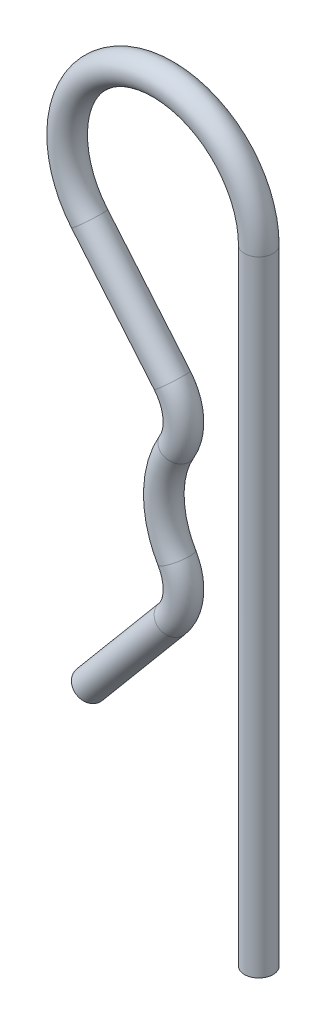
SolidWorks part; units mm, degrees
ref_plane "Plan1" through (0, 0, 0) normal (0, 0, 1) x (1, 0, 0)
ref_plane "Plan2" through (0, 0, 0) normal (0, 1, 0) x (1, 0, 0)
ref_plane "Plan3" through (0, 0, 0) normal (1, 0, 0) x (0, 0, -1)
sketch "Esquisse1" plane through (0, 0, 0) normal (0, 0, 1) x (1, 0, 0)
  line L0 (0, 0) -> (0, 23.55) construction
  line L1 (-10.5974, 12.6371) -> (-5.4182, 6.4611) construction
  line L2 (0, 0) -> (-23.55, 0) construction
  line L4 (0, 16.4925) -> (0, 0) construction
  line L5 (0, 0) -> (0, -22.6075) construction
  line L6 (-6, 22.4925) -> (0, 22.4925) construction
  line L7 (-10.5974, -12.6371) -> (-5.4182, -6.4611) construction
  circle A0 centre (0, 0) radius 23.55 construction
  arc A1 (0, 16.4925) -> (-10.5974, 12.6371) centre (-6, 16.4925) ccw construction
  arc A2 (-5.1302, 3.0138) -> (-5.1302, -3.0138) centre (0, 0) ccw construction
  arc A3 (-5.4182, 6.4611) -> (-5.1302, 3.0138) centre (-7.7169, 4.5334) cw construction
  arc A5 (-5.1302, -3.0138) -> (-5.4182, -6.4611) centre (-7.7169, -4.5334) cw
  dimension "D1" = 47.1
  dimension "D2" = 12
  dimension "D3" = 11.9
  dimension "D7" = 3
  dimension "D4" = 3
  dimension "D6" = 45.1
sketch "Esquisse4" plane through (0, 0, 0) normal (0, 0, 1) x (1, 0, 0)
  line L7 (0, -22.6075) -> (0, 16.4925)
  line L8 (-10.5974, 12.6371) -> (-5.4182, 6.4611) construction
  line L9 (-10.5974, 12.6371) -> (-5.4182, 6.4611)
  line L10 (-10.5974, -12.6371) -> (-5.4182, -6.4611) construction
  line L11 (-10.5974, -12.6371) -> (-5.4182, -6.4611)
  arc A7 (0, 16.4925) -> (-10.5974, 12.6371) centre (-6, 16.4925) ccw construction
  arc A8 (0, 16.4925) -> (-10.5974, 12.6371) centre (-6, 16.4925) ccw
  arc A9 (-5.4182, -6.4611) -> (-5.1302, -3.0138) centre (-7.7169, -4.5334) ccw construction
  arc A10 (-5.1302, 3.0138) -> (-5.1302, -3.0138) centre (0, 0) ccw construction
  arc A11 (-5.1302, 3.0138) -> (-5.4182, 6.4611) centre (-7.7169, 4.5334) ccw construction
  arc A12 (-5.4182, -6.4611) -> (-5.1302, -3.0138) centre (-7.7169, -4.5334) ccw
  arc A13 (-5.1302, 3.0138) -> (-5.1302, -3.0138) centre (0, 0) ccw
  arc A14 (-5.1302, 3.0138) -> (-5.4182, 6.4611) centre (-7.7169, 4.5334) ccw
ref_plane "Plan5" through (0, -22.6075, 0) normal (0, 1, 0) x (-1, 0, 0)
sketch "Esquisse2" plane through (0, -22.6075, 0) normal (0, 1, 0) x (1, 0, 0)
  circle A0 centre (0, 0) radius 0.9
  dimension "D1" = 1.8
sweep "Base-Balayage" add profiles "Esquisse2" path "Esquisse4"
equation "\"D7@Esquisse1\"=\"D2@Esquisse1\"/4"
equation "\"D4@Esquisse1\"=\"D7@Esquisse1\""
